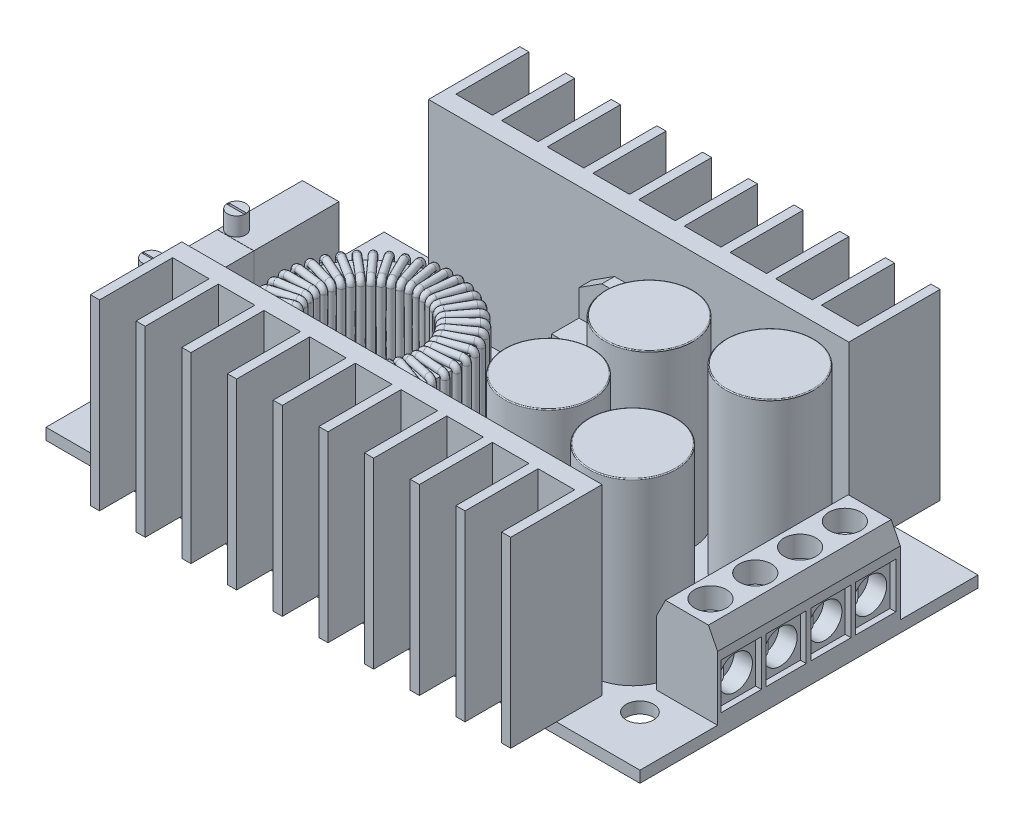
SolidWorks part; units mm, degrees
ref_plane "Front Plane" through (0, 0, 0) normal (0, 0, 1) x (1, 0, 0)
ref_plane "Top Plane" through (0, 0, 0) normal (0, 1, 0) x (1, 0, 0)
ref_plane "Right Plane" through (0, 0, 0) normal (1, 0, 0) x (0, 0, -1)
sketch "Sketch1" plane through (0, 0, 0) normal (0, 1, 0) x (1, 0, 0)
  line L1 (-32.5, -18.5) -> (32.5, -18.5)
  line L2 (-32.5, -18.5) -> (-32.5, 18.5)
  line L3 (-32.5, 18.5) -> (32.5, 18.5)
  line L4 (32.5, -18.5) -> (32.5, 18.5)
  line L5 (-32.5, -18.5) -> (32.5, 18.5) construction
  line L6 (-32.5, 18.5) -> (32.5, -18.5) construction
  point P0 (0, 0)
  dimension "D1" = 37
  dimension "D2" = 65
extrude "Boss-Extrude1" add sketch "Sketch1" along normal blind 1.25
sketch "Sketch2" plane through (0, 1.25, 0) normal (0, 1, 0) x (1, 0, 0)
  line L0 (32.5, 18.5) -> (-32.5, 18.5) construction
  line L1 (-32.5, 18.5) -> (-32.5, -18.5) construction
  line L2 (32.5, -18.5) -> (32.5, 18.5) construction
  line L3 (-32.5, -18.5) -> (32.5, -18.5) construction
  circle A0 centre (-27, 13) radius 1.5
  circle A1 centre (27, 13) radius 1.5
  circle A2 centre (27, -13) radius 1.5
  circle A3 centre (-27, -13) radius 1.5
  dimension "D1" = 3
  dimension "D2" = 3
  dimension "D3" = 3
  dimension "D4" = 3
  dimension "D5" = 5.5
  dimension "D6" = 5.5
  dimension "D7" = 5.5
  dimension "D8" = 5.5
  dimension "D9" = 5.5
  dimension "D10" = 5.5
  dimension "D11" = 5.5
  dimension "D12" = 5.5
extrude "Cut-Extrude1" cut sketch "Sketch2" against normal blind 1.25
sketch "Sketch3" plane through (0, 1.25, 0) normal (0, 1, 0) x (1, 0, 0)
  line L0 (-32.5, 0) -> (32.5, 0) construction
  line L1 (-32.5, 18.5) -> (-32.5, -18.5) construction
  line L2 (32.5, -18.5) -> (32.5, 18.5) construction
  circle A0 centre (20.713, 7.51) radius 4.8
  circle A1 centre (9.5, 5.51) radius 4.8
  circle A2 centre (20.713, -7.51) radius 4.8
  circle A3 centre (9.5, -5.51) radius 4.8
  dimension "D1" = 9.6
  dimension "D2" = 9.6
  dimension "D3" = 11.39
  dimension "D4" = 5.51
  dimension "D5" = 7.51
  dimension "D6" = 9.5
extrude "Boss-Extrude2" add sketch "Sketch3" along normal blind 19.6
sketch "Sketch4" plane through (0, 1.25, 0) normal (0, 1, 0) x (1, 0, 0)
  line L0 (-32.5, 0) -> (32.5, 0) construction
  line L1 (-4.78, -13.5) -> (5.5, -13.5)
  line L2 (-4.78, -13.5) -> (-4.78, -9.11)
  line L3 (-4.78, -9.11) -> (5.5, -9.11)
  line L4 (5.5, -13.5) -> (5.5, -9.11)
  line L5 (-4.78, -13.5) -> (5.5, -9.11) construction
  line L6 (-4.78, -9.11) -> (5.5, -13.5) construction
  line L7 (-32.5, 18.5) -> (-32.5, -18.5) construction
  line L8 (32.5, -18.5) -> (32.5, 18.5) construction
  line L9 (0, 18.5) -> (0, -18.5) construction
  line L10 (32.5, 18.5) -> (-32.5, 18.5) construction
  line L11 (-32.5, -18.5) -> (32.5, -18.5) construction
  line L12 (-4.78, 9.11) -> (5.5, 9.11)
  line L13 (5.5, 13.5) -> (5.5, 9.11)
  line L14 (-4.78, 13.5) -> (5.5, 13.5)
  line L15 (-4.78, 13.5) -> (-4.78, 9.11)
  point P0 (0.36, -11.305)
  point P17 (5.5, -11.305)
  dimension "D1" = 4.39
  dimension "D2" = 10.28
  dimension "D3" = 9.11
  dimension "D4" = 5.5
extrude "Boss-Extrude3" add sketch "Sketch4" along normal blind 8.9
sketch "Sketch7" plane through (0, 10.15, 0) normal (0, 1, 0) x (1, 0, 0)
  line L0 (5.5, 9.11) -> (5.5, 13.5) construction
  line L1 (-4.78, 13.5) -> (5.5, 13.5)
  line L2 (-4.78, 13.5) -> (-4.78, 12.11)
  line L3 (-4.78, 12.11) -> (5.5, 12.11)
  line L4 (5.5, 13.5) -> (5.5, 12.11)
  dimension "D1" = 1.39
sketch "Sketch8" plane through (0, 10.15, 0) normal (0, 1, 0) x (1, 0, 0)
  line L0 (5.5, -13.5) -> (5.5, -9.11) construction
  line L1 (-4.78, -13.5) -> (5.5, -13.5)
  line L2 (-4.78, -13.5) -> (-4.78, -12.11)
  line L3 (-4.78, -12.11) -> (5.5, -12.11)
  line L4 (5.5, -13.5) -> (5.5, -12.11)
  dimension "D1" = 1.39
extrude "Boss-Extrude4" add sketch "Sketch7" along normal blind 4.5
extrude "Boss-Extrude5" add sketch "Sketch8" along normal blind 4.5
sketch "Sketch9" plane through (0, 0, -12.11) normal (0, 0, 1) x (1, 0, 0)
  line L0 (-4.78, 14.65) -> (-2.28, 14.65)
  line L1 (-4.78, 14.65) -> (5.5, 14.65) construction
  line L2 (-2.28, 14.65) -> (-4.78, 13.05)
  line L3 (-4.78, 14.65) -> (-4.78, 10.15) construction
  line L4 (-4.78, 13.05) -> (-4.78, 14.65)
  line L5 (3, 14.65) -> (5.5, 14.65)
  line L6 (5.5, 14.65) -> (5.5, 13.05)
  line L7 (5.5, 14.65) -> (5.5, 10.15) construction
  line L8 (5.5, 13.05) -> (3, 14.65)
  dimension "D1" = 2.5
  dimension "D2" = 2.5
  dimension "D3" = 1.6
  dimension "D4" = 1.6
extrude "Cut-Extrude4" cut sketch "Sketch9" against normal blind 1.39
sketch "Sketch10" plane through (0, 0, 12.11) normal (0, 0, -1) x (-1, 0, 0)
  line L0 (-5.5, 14.65) -> (-3, 14.65)
  line L1 (-5.5, 14.65) -> (4.78, 14.65) construction
  line L2 (-3, 14.65) -> (-5.5, 13.05)
  line L3 (-5.5, 14.65) -> (-5.5, 10.15) construction
  line L4 (-5.5, 13.05) -> (-5.5, 14.65)
  line L5 (4.78, 14.65) -> (2.28, 14.65)
  line L6 (2.28, 14.65) -> (4.78, 13.05)
  line L7 (4.78, 14.65) -> (4.78, 10.15) construction
  line L8 (4.78, 13.05) -> (4.78, 14.65)
  dimension "D1" = 2.5
  dimension "D2" = 2.5
  dimension "D3" = 1.6
  dimension "D4" = 1.6
extrude "Cut-Extrude5" cut sketch "Sketch10" against normal blind 1.39
sketch "Sketch13" plane through (0, 1.25, 0) normal (0, 1, 0) x (1, 0, 0)
  line L0 (-4.78, -13.5) -> (5.5, -13.5) construction
  line L1 (-22.64, -13.5) -> (23.36, -13.5)
  line L2 (-22.64, -13.5) -> (-22.64, -15.5)
  line L3 (-21.64, -15.5) -> (-17.64, -15.5)
  line L4 (23.36, -13.5) -> (23.36, -15.5)
  line L5 (-22.64, -13.5) -> (23.36, -15.5) construction
  line L6 (-22.64, -15.5) -> (23.36, -13.5) construction
  line L7 (-17.64, -15.5) -> (-17.64, -23.5)
  line L8 (-4.78, -9.11) -> (-4.78, -13.5) construction
  line L9 (-16.64, -15.5) -> (-12.64, -15.5)
  line L10 (-22.64, -15.5) -> (-22.64, -23.5)
  line L11 (-22.64, -23.5) -> (-21.64, -23.5)
  line L12 (-21.64, -15.5) -> (-21.64, -23.5)
  line L13 (-17.64, -23.5) -> (-16.64, -23.5)
  line L14 (-16.64, -15.5) -> (-16.64, -23.5)
  line L15 (-12.64, -15.5) -> (-12.64, -23.5)
  line L16 (-12.64, -23.5) -> (-11.64, -23.5)
  line L17 (-11.64, -15.5) -> (-11.64, -23.5)
  line L18 (-7.64, -15.5) -> (-7.64, -23.5)
  line L19 (-7.64, -23.5) -> (-6.64, -23.5)
  line L20 (-6.64, -15.5) -> (-6.64, -23.5)
  line L21 (-2.64, -15.5) -> (-2.64, -23.5)
  line L22 (-2.64, -23.5) -> (-1.64, -23.5)
  line L23 (-1.64, -15.5) -> (-1.64, -23.5)
  line L24 (2.36, -15.5) -> (2.36, -23.5)
  line L25 (2.36, -23.5) -> (3.36, -23.5)
  line L26 (3.36, -15.5) -> (3.36, -23.5)
  line L27 (7.36, -15.5) -> (7.36, -23.5)
  line L28 (7.36, -23.5) -> (8.36, -23.5)
  line L29 (8.36, -15.5) -> (8.36, -23.5)
  line L30 (12.36, -15.5) -> (12.36, -23.5)
  line L31 (12.36, -23.5) -> (13.36, -23.5)
  line L32 (13.36, -15.5) -> (13.36, -23.5)
  line L33 (17.36, -15.5) -> (17.36, -23.5)
  line L34 (17.36, -23.5) -> (18.36, -23.5)
  line L35 (18.36, -15.5) -> (18.36, -23.5)
  line L36 (22.36, -15.5) -> (22.36, -23.5)
  line L37 (22.36, -23.5) -> (23.36, -23.5)
  line L38 (23.36, -15.5) -> (23.36, -23.5)
  line L39 (-11.64, -15.5) -> (-7.64, -15.5)
  line L40 (-6.64, -15.5) -> (-2.64, -15.5)
  line L41 (-1.64, -15.5) -> (2.36, -15.5)
  line L42 (3.36, -15.5) -> (7.36, -15.5)
  line L43 (8.36, -15.5) -> (12.36, -15.5)
  line L44 (13.36, -15.5) -> (17.36, -15.5)
  line L45 (18.36, -15.5) -> (22.36, -15.5)
  line L46 (-32.5, 0) -> (32.5, 0) construction
  line L47 (-32.5, 18.5) -> (-32.5, -18.5) construction
  line L48 (32.5, -18.5) -> (32.5, 18.5) construction
  line L49 (23.36, 13.5) -> (23.36, 15.5)
  line L50 (23.36, 15.5) -> (23.36, 23.5)
  line L51 (22.36, 23.5) -> (23.36, 23.5)
  line L52 (22.36, 15.5) -> (22.36, 23.5)
  line L53 (18.36, 15.5) -> (22.36, 15.5)
  line L54 (18.36, 15.5) -> (18.36, 23.5)
  line L55 (17.36, 23.5) -> (18.36, 23.5)
  line L56 (17.36, 15.5) -> (17.36, 23.5)
  line L57 (13.36, 15.5) -> (17.36, 15.5)
  line L58 (13.36, 15.5) -> (13.36, 23.5)
  line L59 (12.36, 23.5) -> (13.36, 23.5)
  line L60 (12.36, 15.5) -> (12.36, 23.5)
  line L61 (8.36, 15.5) -> (12.36, 15.5)
  line L62 (8.36, 15.5) -> (8.36, 23.5)
  line L63 (7.36, 23.5) -> (8.36, 23.5)
  line L64 (7.36, 15.5) -> (7.36, 23.5)
  line L65 (3.36, 15.5) -> (7.36, 15.5)
  line L66 (3.36, 15.5) -> (3.36, 23.5)
  line L67 (2.36, 23.5) -> (3.36, 23.5)
  line L68 (2.36, 15.5) -> (2.36, 23.5)
  line L69 (-1.64, 15.5) -> (2.36, 15.5)
  line L70 (-1.64, 15.5) -> (-1.64, 23.5)
  line L71 (-2.64, 23.5) -> (-1.64, 23.5)
  line L72 (-2.64, 15.5) -> (-2.64, 23.5)
  line L73 (-6.64, 15.5) -> (-2.64, 15.5)
  line L74 (-6.64, 15.5) -> (-6.64, 23.5)
  line L75 (-7.64, 23.5) -> (-6.64, 23.5)
  line L76 (-7.64, 15.5) -> (-7.64, 23.5)
  line L77 (-11.64, 15.5) -> (-7.64, 15.5)
  line L78 (-11.64, 15.5) -> (-11.64, 23.5)
  line L79 (-12.64, 23.5) -> (-11.64, 23.5)
  line L80 (-12.64, 15.5) -> (-12.64, 23.5)
  line L81 (-16.64, 15.5) -> (-12.64, 15.5)
  line L82 (-16.64, 15.5) -> (-16.64, 23.5)
  line L83 (-17.64, 23.5) -> (-16.64, 23.5)
  line L84 (-17.64, 15.5) -> (-17.64, 23.5)
  line L85 (-21.64, 15.5) -> (-17.64, 15.5)
  line L86 (-21.64, 15.5) -> (-21.64, 23.5)
  line L87 (-22.64, 23.5) -> (-21.64, 23.5)
  line L88 (-22.64, 15.5) -> (-22.64, 23.5)
  line L89 (-22.64, 13.5) -> (-22.64, 15.5)
  line L90 (-22.64, 13.5) -> (23.36, 13.5)
  point P0 (0.36, -14.5)
  dimension "D1" = 0
  dimension "D2" = 46
  dimension "D3" = 17.86
  dimension "D4" = 2
  dimension "D5" = 8
  dimension "D6" = 1
  dimension "D7" = 10
extrude "Boss-Extrude6" add sketch "Sketch13" along normal blind 20
sketch "Sketch14" plane through (0, 0, -12.11) normal (0, 0, 1) x (1, 0, 0)
  line L0 (-2.28, 14.65) -> (3, 14.65) construction
  circle A0 centre (0.36, 12.65) radius 1.5
  dimension "D1" = 3
  dimension "D2" = 2
sketch "Sketch15" plane through (0, 0, 12.11) normal (0, 0, -1) x (-1, 0, 0)
  line L0 (-3, 14.65) -> (2.28, 14.65) construction
  circle A0 centre (-0.36, 12.65) radius 1.5
  dimension "D1" = 3
  dimension "D2" = 2
extrude "Cut-Extrude6" cut sketch "Sketch14" against normal blind 3.39
extrude "Cut-Extrude7" cut sketch "Sketch15" against normal blind 3.39
sketch "Sketch17" plane through (0, 1.25, 0) normal (0, 1, 0) x (1, 0, 0)
  line L0 (-32.5, 0) -> (32.5, 0) construction
  line L1 (-32.5, 18.5) -> (-32.5, -18.5) construction
  line L2 (32.5, -18.5) -> (32.5, 18.5) construction
  line L3 (-28.25, -0.01) -> (-28.25, -9.31)
  line L4 (-32.25, 0.01) -> (-28.25, 0.01)
  line L5 (-32.25, 0.01) -> (-32.25, 9.31)
  line L6 (-32.25, 9.31) -> (-28.25, 9.31)
  line L7 (-28.25, 0.01) -> (-28.25, 9.31)
  line L8 (-32.25, 0.01) -> (-28.25, 9.31) construction
  line L9 (-32.25, 9.31) -> (-28.25, 0.01) construction
  line L10 (-32.25, -0.01) -> (-28.25, -0.01)
  line L11 (-32.25, -0.01) -> (-32.25, -9.31)
  line L12 (-32.25, -9.31) -> (-28.25, -9.31)
  point P6 (-30.25, 4.66)
  point P11 (-30.25, 9.31)
  dimension "D1" = 4
  dimension "D2" = 9.3
  dimension "D3" = 9.31
  dimension "D4" = 0.25
extrude "Boss-Extrude7" add sketch "Sketch17" along normal blind 9.6
sketch "Sketch18" plane through (0, 10.85, 0) normal (0, 1, 0) x (1, 0, 0)
  line L0 (-32.25, 9.31) -> (-32.25, 0.01) construction
  line L1 (-32.25, 0.01) -> (-28.25, 0.01) construction
  circle A0 centre (-31.2, 1.06) radius 1
  dimension "D1" = 2
  dimension "D2" = 1.05
  dimension "D3" = 1.05
sketch "Sketch19" plane through (0, 10.85, 0) normal (0, 1, 0) x (1, 0, 0)
  line L0 (-32.25, -0.01) -> (-32.25, -9.31) construction
  line L1 (-32.25, -9.31) -> (-28.25, -9.31) construction
  circle A0 centre (-31.2, -8.26) radius 1
  dimension "D1" = 2
  dimension "D2" = 1.05
  dimension "D3" = 1.05
extrude "Boss-Extrude8" add sketch "Sketch18" along normal blind 2
extrude "Boss-Extrude9" add sketch "Sketch19" along normal blind 2
sketch "Sketch24" plane through (0, 12.85, 0) normal (0, 1, 0) x (1, 0, 0)
  line L1 (-32.175, -8.34) -> (-30.225, -8.34)
  line L2 (-32.175, -8.34) -> (-32.175, -8.18)
  line L3 (-32.175, -8.18) -> (-30.225, -8.18)
  line L4 (-30.225, -8.34) -> (-30.225, -8.18)
  line L5 (-32.175, -8.34) -> (-30.225, -8.18) construction
  line L6 (-32.175, -8.18) -> (-30.225, -8.34) construction
  circle A0 centre (-31.2, -8.26) radius 1 construction
  point P0 (-31.2, -8.26)
  dimension "D1" = 0
  dimension "D2" = 1.95
  dimension "D3" = 0.16
extrude "Cut-Extrude11" cut sketch "Sketch24" against normal blind 0.4
sketch "Sketch25" plane through (0, 12.85, 0) normal (0, 1, 0) x (1, 0, 0)
  line L1 (-32.175, 1.1759) -> (-30.225, 1.1759)
  line L2 (-32.175, 1.1759) -> (-32.175, 0.9441)
  line L3 (-32.175, 0.9441) -> (-30.225, 0.9441)
  line L4 (-30.225, 1.1759) -> (-30.225, 0.9441)
  line L5 (-32.175, 1.1759) -> (-30.225, 0.9441) construction
  line L6 (-32.175, 0.9441) -> (-30.225, 1.1759) construction
  circle A0 centre (-31.2, 1.06) radius 1 construction
  point P0 (-31.2, 1.06)
  dimension "D1" = 0
  dimension "D2" = 1.95
extrude "Cut-Extrude12" cut sketch "Sketch25" against normal blind 0.4
sketch "Sketch26" plane through (0, 1.25, 0) normal (0, 1, 0) x (1, 0, 0)
  line L0 (-32.25, -0.01) -> (32.5, 0) construction
  line L1 (32.5, -18.5) -> (32.5, 18.5) construction
  circle A0 centre (-15.87, -0.0075) radius 6.15
  circle A1 centre (-15.87, -0.0075) radius 8.85
  dimension "D1" = 17.7
  dimension "D2" = 12.3
  dimension "D3" = 12.38
extrude "Boss-Extrude10" add sketch "Sketch26" along normal blind 8.67
fillet "Fillet1" radius 0.1 1 edges at (9.5, 20.85, -0.71)
fillet "Fillet2" radius 0.1 1 edges at (9.5, 20.85, 0.71)
fillet "Fillet3" radius 0.1 1 edges at (20.713, 20.85, -2.71)
fillet "Fillet4" radius 0.1 1 edges at (20.713, 20.85, 2.71)
sketch "Sketch29" plane through (0, 1.25, 0) normal (0, 1, 0) x (1, 0, 0)
  line L0 (-32.5, 0) -> (32.5, 0) construction
  line L1 (-32.5, 18.5) -> (-32.5, -18.5) construction
  line L2 (32.5, -18.5) -> (32.5, 18.5) construction
  line L4 (25.8, -10) -> (32.5, -10)
  line L5 (25.8, -10) -> (25.8, 10)
  line L6 (25.8, 10) -> (32.5, 10)
  line L7 (32.5, -10) -> (32.5, 10)
  line L8 (25.8, -10) -> (32.5, 10) construction
  line L9 (25.8, 10) -> (32.5, -10) construction
  point P6 (29.15, 0)
  dimension "D1" = 6.7
  dimension "D2" = 0
  dimension "D3" = 20
extrude "Boss-Extrude11" add sketch "Sketch29" along normal blind 9
sketch "Sketch31" plane through (0, 0, 10) normal (0, 0, 1) x (1, 0, 0)
  line L0 (25.8, 10.25) -> (26.8, 10.25)
  line L1 (25.8, 10.25) -> (32.5, 10.25) construction
  line L2 (26.8, 10.25) -> (25.8, 8.25)
  line L3 (25.8, 10.25) -> (25.8, 1.25) construction
  line L4 (25.8, 8.25) -> (25.8, 10.25)
  line L5 (32.5, 10.25) -> (31.5, 10.25)
  line L6 (31.5, 10.25) -> (32.5, 8.25)
  line L7 (32.5, 10.25) -> (32.5, 1.25) construction
  line L8 (32.5, 8.25) -> (32.5, 10.25)
  dimension "D1" = 1
  dimension "D2" = 1
  dimension "D3" = 2
  dimension "D4" = 2
extrude "Cut-Extrude13" cut sketch "Sketch31" against normal blind 20
sketch "Sketch32" plane through (0, 10.25, 0) normal (0, 1, 0) x (1, 0, 0)
  line L0 (26.8, -10) -> (31.5, -10) construction
  circle A0 centre (29.127, -7.4) radius 1.75
  circle A1 centre (29.127, -2.5) radius 1.75
  circle A2 centre (29.127, 2.4) radius 1.75
  circle A3 centre (29.127, 7.3) radius 1.75
  dimension "D1" = 3.5
  dimension "D2" = 2.6
  dimension "D3" = 4
extrude "Cut-Extrude14" cut sketch "Sketch32" against normal blind 2.3
sketch "Sketch33" plane through (32.5, 0, 0) normal (1, 0, 0) x (0, 0, -1)
  line L0 (10, 4.75) -> (-10, 4.75) construction
  line L1 (10, 8.25) -> (10, 1.25) construction
  line L2 (-10, 8.25) -> (-10, 1.25) construction
  line L3 (-4.7, 2.25) -> (-0.3, 2.25)
  line L4 (-9.6, 7.25) -> (-5.2, 7.25)
  line L5 (-9.6, 7.25) -> (-9.6, 2.25)
  line L6 (-9.6, 2.25) -> (-5.2, 2.25)
  line L7 (-5.2, 7.25) -> (-5.2, 2.25)
  line L8 (-9.6, 7.25) -> (-5.2, 2.25) construction
  line L9 (-9.6, 2.25) -> (-5.2, 7.25) construction
  line L10 (-0.3, 7.25) -> (-0.3, 2.25)
  line L11 (-4.7, 7.25) -> (-0.3, 7.25)
  line L12 (-4.7, 7.25) -> (-4.7, 2.25)
  line L13 (0.2, 2.25) -> (4.6, 2.25)
  line L14 (4.6, 7.25) -> (4.6, 2.25)
  line L15 (0.2, 7.25) -> (4.6, 7.25)
  line L16 (0.2, 7.25) -> (0.2, 2.25)
  line L17 (5.1, 2.25) -> (9.5, 2.25)
  line L18 (9.5, 7.25) -> (9.5, 2.25)
  line L19 (5.1, 7.25) -> (9.5, 7.25)
  line L20 (5.1, 7.25) -> (5.1, 2.25)
  point P6 (-7.4, 4.75)
  dimension "D1" = 4.4
  dimension "D2" = 5
  dimension "D3" = 2.6
  dimension "D4" = 4
extrude "Cut-Extrude15" cut sketch "Sketch33" against normal blind 0.64
sketch "Sketch35" plane through (0, 7.95, 0) normal (0, 1, 0) x (1, 0, 0)
  circle A0 centre (29.127, -7.4) radius 1
  circle A1 centre (29.127, -2.5) radius 1
  circle A2 centre (29.127, 2.4) radius 1
  circle A3 centre (29.127, 7.3) radius 1
  dimension "D1" = 2
  dimension "D2" = 4
extrude "Cut-Extrude18" cut sketch "Sketch35" against normal blind 7.85
sketch "Sketch34" plane through (31.86, 0, 0) normal (1, 0, 0) x (0, 0, -1)
  line L0 (-9.6, 2.25) -> (-5.2, 2.25) construction
  line L1 (-9.6, 7.25) -> (-9.6, 2.25) construction
  circle A0 centre (-7.4, 4.64) radius 1.85
  circle A1 centre (-2.5, 4.64) radius 1.85
  circle A2 centre (2.4, 4.64) radius 1.85
  circle A3 centre (7.3, 4.64) radius 1.85
  dimension "D1" = 3.7
  dimension "D4" = 4
  dimension "D2" = 2.39
  dimension "D3" = 2.2
extrude "Cut-Extrude16" cut sketch "Sketch34" against normal blind 2
sketch "Sketch37" plane through (0, 0, 0) normal (0, 0, 1) x (1, 0, 0)
  line L0 (-24.6533, 10.295) -> (-21.9559, 10.295)
  line L1 (-21.5809, 9.9174) -> (-21.64, 1.25)
  line L2 (-25.0283, 9.92) -> (-25.0283, 1.25)
  line L3 (-7.02, 9.92) -> (-24.72, 9.92) construction
  line L5 (-32.5, 1.25) -> (-22.64, 1.25) construction
  arc A0 (-21.9559, 10.295) -> (-21.5809, 9.9174) centre (-21.9559, 9.92) cw
  arc A1 (-24.6533, 10.295) -> (-25.0283, 9.92) centre (-24.6533, 9.92) ccw
  point P11 (-21.5783, 10.295)
  point P14 (-25.0283, 10.295)
  dimension "D3" = 0.375
  dimension "D1" = 3.45
  dimension "D2" = 0.375
sketch "Sketch39" plane through (0, 1.25, 0) normal (0, 1, 0) x (1, 0, 0)
  line L0 (-24.6533, 0) -> (-21.9559, 0) construction
  circle A0 centre (-21.5783, 0) radius 0.375
  dimension "D1" = 0.75
sweep "Sweep1" add profiles "Sketch39" path "Sketch37"
pattern_circular "CirPattern1" count 45 every 8 of "Sweep1"
